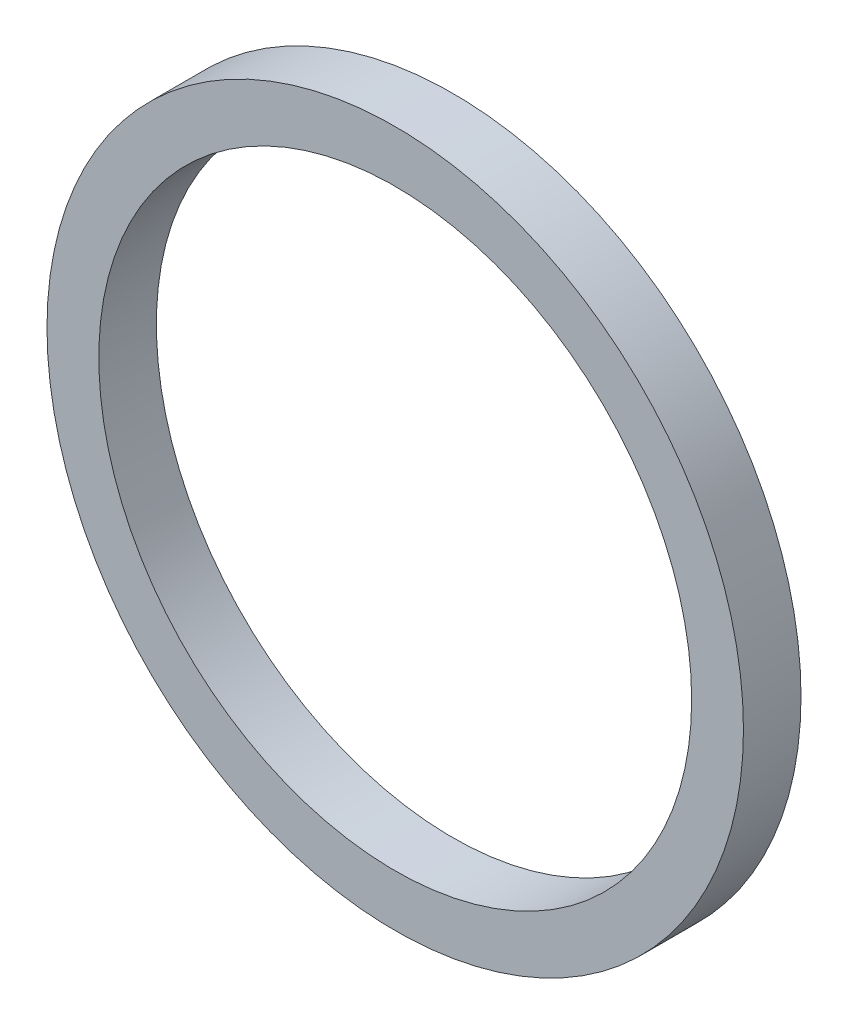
SolidWorks part; units mm, degrees
ref_plane "Спереди" through (0, 0, 0) normal (0, 0, 1) x (1, 0, 0)
ref_plane "Сверху" through (0, 0, 0) normal (0, 1, 0) x (1, 0, 0)
ref_plane "Справа" through (0, 0, 0) normal (1, 0, 0) x (0, 0, -1)
sketch "Эскиз1" plane through (0, 0, 0) normal (0, 0, 1) x (1, 0, 0)
  circle A0 centre (-30.6252, 42.4042) radius 5.15
  circle A1 centre (-30.6252, 42.4042) radius 6.05
  circle A2 centre (-30.6252, 42.4042) radius 11.2116
  circle A3 centre (-30.6252, 42.4042) radius 7.5
  dimension "D1" = 10.3
  dimension "D2" = 12.1
  dimension "D3" = 15
extrude "Бобышка-Вытянуть1" add sketch "Эскиз1" along normal blind 1 contours A1 A0
